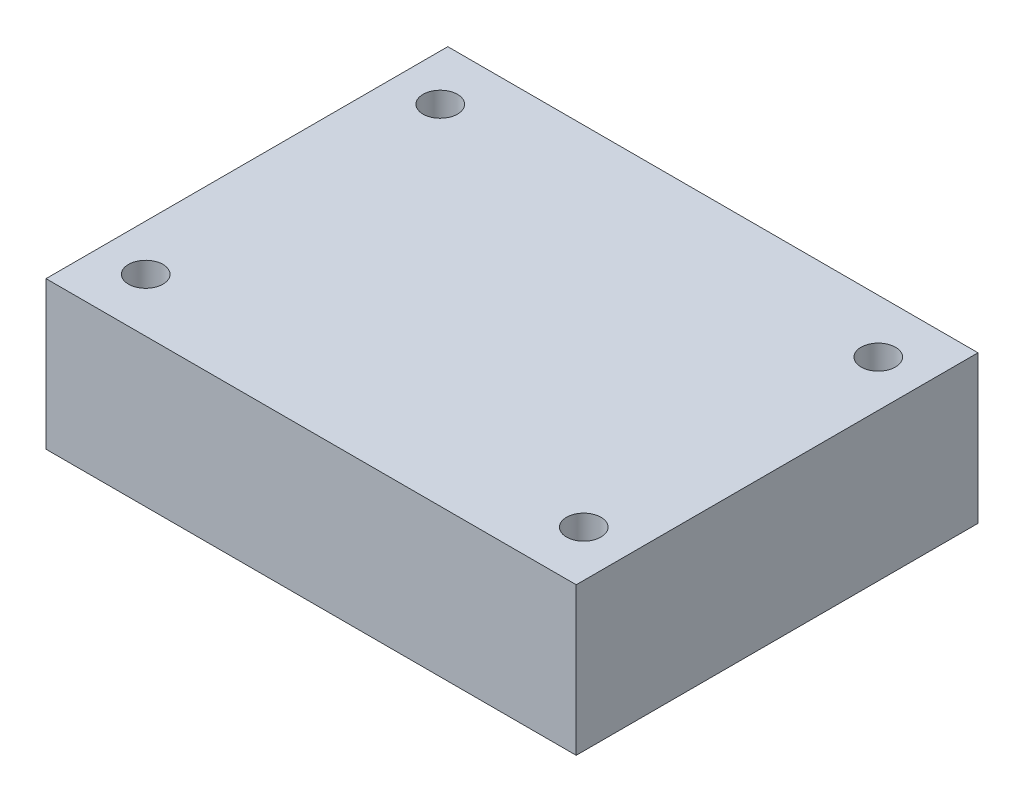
SolidWorks part; units mm, degrees
ref_plane "Front Plane" through (0, 0, 0) normal (0, 0, 1) x (1, 0, 0)
ref_plane "Top Plane" through (0, 0, 0) normal (0, 1, 0) x (1, 0, 0)
ref_plane "Right Plane" through (0, 0, 0) normal (1, 0, 0) x (0, 0, -1)
sketch "Sketch1" plane through (0, 0, 0) normal (0, 1, 0) x (1, 0, 0)
  line L1 (-73.3774, 55.6055) -> (73.3774, 55.6055)
  line L2 (-73.3774, 55.6055) -> (-73.3774, -55.6055)
  line L3 (-73.3774, -55.6055) -> (73.3774, -55.6055)
  line L4 (73.3774, 55.6055) -> (73.3774, -55.6055)
  line L5 (-73.3774, 55.6055) -> (73.3774, -55.6055) construction
  line L6 (-73.3774, -55.6055) -> (73.3774, 55.6055) construction
  point P0 (0, 0)
extrude "Boss-Extrude1" add sketch "Sketch1" along normal blind 40.894
sketch "Sketch2" plane through (0, 40.894, 0) normal (0, 1, 0) x (1, 0, 0)
  line L0 (0, 17.3985) -> (0, 0) construction
  line L1 (0, 0) -> (13.9216, 0) construction
  circle A0 centre (-60.6179, 40.7604) radius 4.7625
  circle A1 centre (60.6179, 40.7604) radius 4.7625
  circle A2 centre (-60.6179, -40.7604) radius 4.7625
  circle A3 centre (60.6179, -40.7604) radius 4.7625
  dimension "D1" = 9.525
extrude "Cut-Extrude1" cut sketch "Sketch2" against normal through all
